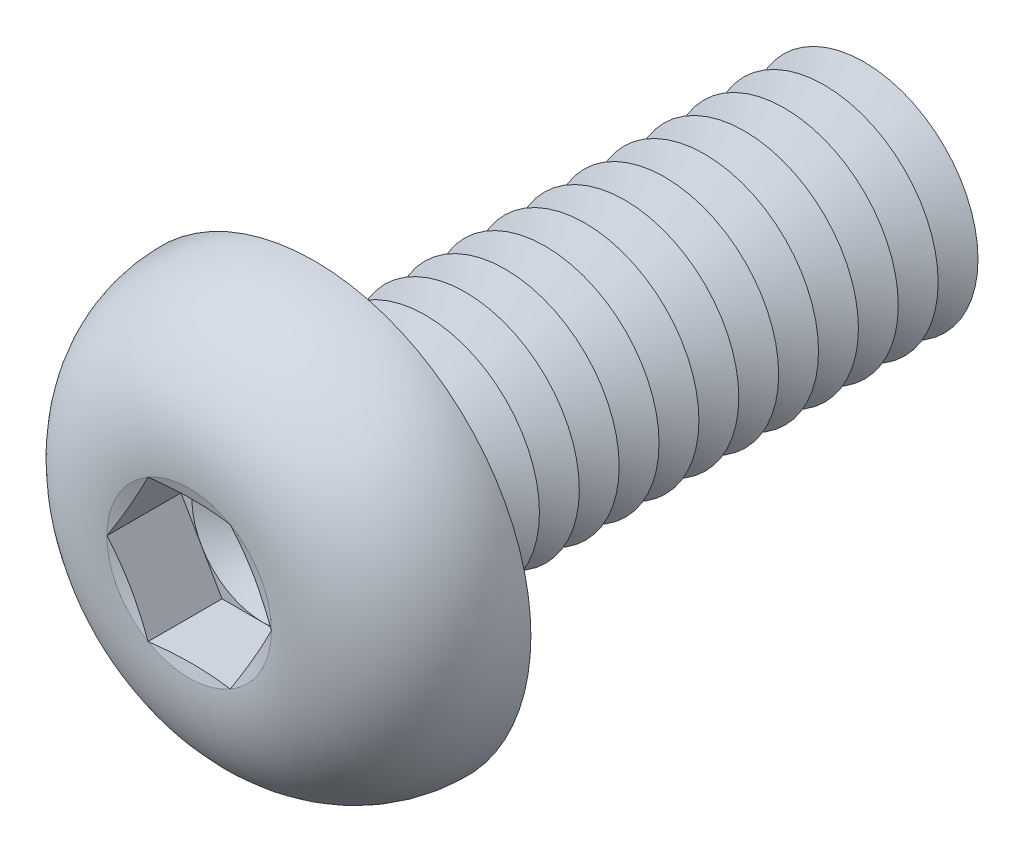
SolidWorks part; units mm, degrees
ref_plane "Front Plane" through (0, 0, 0) normal (0, 0, 1) x (1, 0, 0)
ref_plane "Top Plane" through (0, 0, 0) normal (0, 1, 0) x (1, 0, 0)
ref_plane "Right Plane" through (0, 0, 0) normal (1, 0, 0) x (0, 0, -1)
sketch "Sketch1" plane through (0, 0, 0) normal (1, 0, 0) x (0, 0, -1)
  line L0 (0, 2) -> (0, 3.8)
  line L3 (0, 2) -> (10, 2)
  line L4 (10, 2) -> (10, 0)
  line L5 (10, 0) -> (-2.2, 0) construction
  line L6 (-2.2, 0) -> (10, 0)
  line L7 (-2.2, 1.4434) -> (-2.2, 0.7217) construction
  line L8 (-2.2, 0.7217) -> (-2.2, 0)
  line L9 (-2.2, 1.4434) -> (-2.0066, 0.7217)
  line L10 (-2.0066, 0.7217) -> (-2.2, 0.7217)
  line L11 (10, 0) -> (22.7481, 0) construction
  line L12 (0, 3.8) -> (-2.2, 3.8) construction
  arc A1 (0, 3.8) -> (-2.2, 1.4434) centre (0, 1.5948) ccw
  point P8 (10, 1)
  dimension "D1" = 7.6
  dimension "D2" = 4
  dimension "D3" = 2.2
  dimension "D4" = 2.8868
  dimension "D5" = 10
  dimension "D6" = 15
revolve "Revolve1" add sketch "Sketch1" angle 360 about L5
fillet "Fillet1" radius 0.35 1 edges at (-2, 0, 0)
sketch "Sketch2" plane through (0, 0, 0) normal (1, 0, 0) x (0, 0, -1)
  line L0 (9.65, 2) -> (10.35, 2)
  line L1 (10, 2) -> (0.35, 2) construction
  line L2 (10.35, 2) -> (10, 1.3938)
  line L3 (10, -2) -> (10, 2) construction
  line L4 (10, 1.3938) -> (9.65, 2)
  dimension "D1" = 0.7
revolve "Cut-Revolve1" cut sketch "Sketch2" angle 360 about axis through (0, 0, -10) along (0, 0, -1)
pattern_linear "LPattern1" count 14 spacing 0.7 along (0, 0, 1) of "Cut-Revolve1"
sketch "Sketch3" plane through (0, 0, 2.2) normal (0, 0, 1) x (1, 0, 0)
  line L7 (0.7217, 1.25) -> (-0.7217, 1.25)
  line L8 (-0.7217, 1.25) -> (-1.4434, 0)
  line L9 (-1.4434, 0) -> (-0.7217, -1.25)
  line L10 (-0.7217, -1.25) -> (0.7217, -1.25)
  line L11 (0.7217, -1.25) -> (1.4434, 0)
  line L12 (1.4434, 0) -> (0.7217, 1.25)
  circle A0 centre (0, 0) radius 1.25 construction
  circle A3 centre (0, 0) radius 1.4434 construction
extrude "Cut-Extrude1" cut sketch "Sketch3" against normal blind 1.3
sketch "Sketch4" plane through (0, 0, 0.9) normal (0, 0, 1) x (1, 0, 0)
  line L1 (0.7217, 1.25) -> (-0.7217, 1.25) construction
  circle A0 centre (0, 0) radius 1.25
extrude "Cut-Extrude2" cut sketch "Sketch4" against normal through all draft 60
